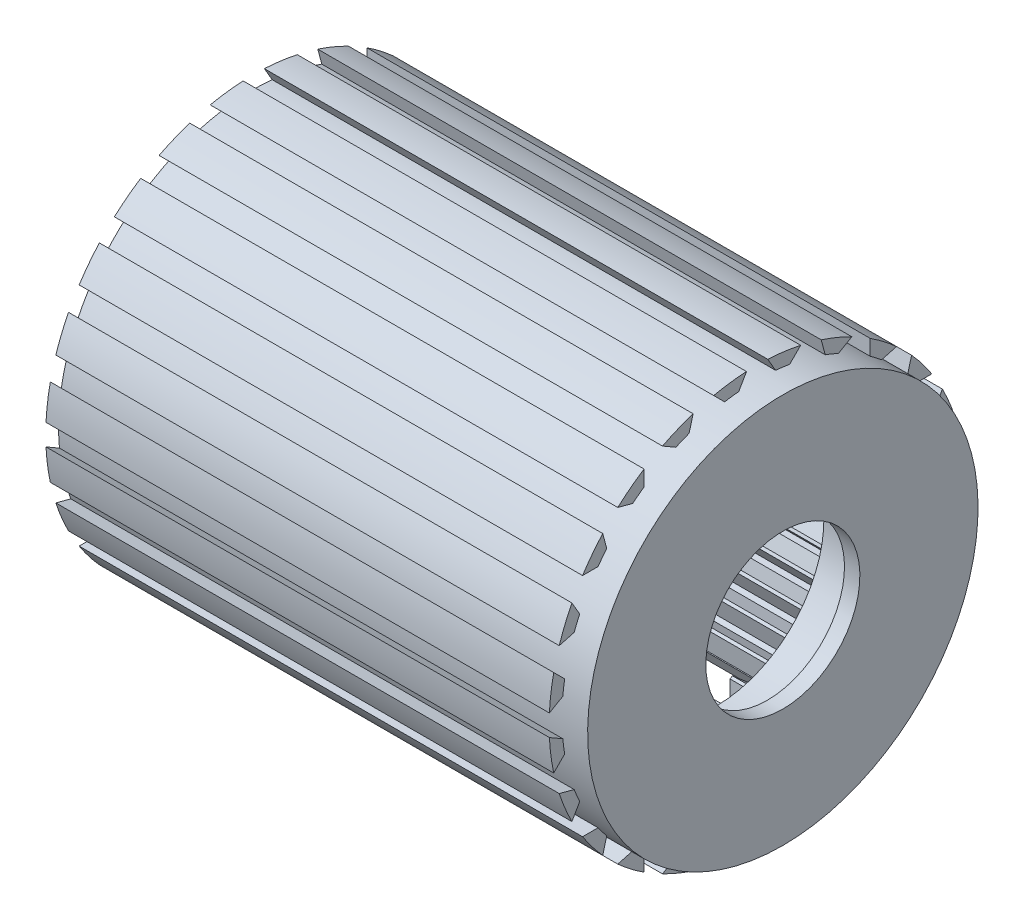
SolidWorks part; units mm, degrees
ref_plane "Plan1" through (0, 0, 0) normal (0, 0, 1) x (1, 0, 0)
ref_plane "Plan2" through (0, 0, 0) normal (0, 1, 0) x (1, 0, 0)
ref_plane "Plan3" through (0, 0, 0) normal (1, 0, 0) x (0, 0, -1)
sketch "Esquisse1" plane through (0, 0, 0) normal (0, 0, 1) x (1, 0, 0)
  line L0 (-68.3031, 40.5) -> (29.6969, 40.5)
  line L1 (29.6969, 40.5) -> (29.6969, 38)
  line L2 (29.6969, 38) -> (34.6969, 38)
  line L3 (34.6969, 38) -> (34.6969, 15)
  line L4 (34.6969, 15) -> (31.6969, 15)
  line L5 (31.6969, 15) -> (31.6969, 21)
  line L6 (31.6969, 21) -> (21.6969, 21)
  line L7 (21.6969, 21) -> (21.6969, 23)
  line L8 (21.6969, 23) -> (31.6969, 23)
  line L9 (31.6969, 23) -> (31.6969, 30.5)
  line L10 (31.6969, 30.5) -> (16.9403, 30.5)
  line L11 (16.9403, 30.5) -> (-25.3031, 30.5)
  line L12 (-25.3031, 30.5) -> (-25.3031, 34.5)
  line L13 (-25.3031, 34.5) -> (-68.3031, 34.5)
  line L14 (-68.3031, 34.5) -> (-68.3031, 40.5)
  line L15 (-68.3031, 0) -> (68.3031, 0) construction
  dimension "D1" = 98
  dimension "D2" = 43
  dimension "D3" = 40.5
  dimension "D4" = 34.5
  dimension "D5" = 38
  dimension "D6" = 15
  dimension "D7" = 21
  dimension "D8" = 10
  dimension "D9" = 3
  dimension "D10" = 2
  dimension "D11" = 4
  dimension "D12" = 100
revolve "Base-Révolution" add sketch "Esquisse1" angle 360 about L15
sketch "Esquisse2" plane through (29.6969, 0, 0) normal (1, 0, 0) x (0, 0, -1)
  line L0 (0, 0) -> (-43.5058, 0) construction
  line L1 (-41, -1.75) -> (-41, 1.75)
  line L2 (-41, 1.75) -> (-37.831, 3.5796)
  line L3 (-41, -1.75) -> (-37.831, -3.5796)
  circle A0 centre (0, 0) radius 38 construction
  arc A1 (-37.831, 3.5796) -> (-37.831, -3.5796) centre (0, 0) ccw
  point P7 (-41, 0)
  dimension "D1" = 3.5
  dimension "D2" = 41
  dimension "D3" = 120
extrude "Enlèv. mat.-Extru.1" cut sketch "Esquisse2" against normal through all
pattern_circular "Répétition circulaire1" count 28 every 15 about axis through (-68.3031, 0, 0) along (1, 0, 0)
sketch "Esquisse3" plane through (-25.3031, 0, 0) normal (-1, 0, 0) x (0, 0, 1)
  line L0 (0, 0) -> (0, 50.1709) construction
  line L1 (0.4625, 34.4969) -> (2.6417, 28.5097)
  line L2 (-0.4625, 34.4969) -> (-2.6417, 28.5097)
  line L3 (-0.4625, 34.4969) -> (0.4625, 34.4969)
  line L4 (2.6417, 28.5097) -> (-2.6417, 28.5097)
  circle A0 centre (0, 0) radius 34.5 construction
  point P9 (0, 32.0082)
  dimension "D1" = 20
extrude "Enlèv. mat.-Extru.2" cut sketch "Esquisse3" against normal up to surface (57 mm away)
pattern_circular "Répétition circulaire3" count 43 every 8.372
sketch "Esquisse4" plane through (0, 0, 0) normal (0, 0, 1) x (1, 0, 0)
  line L0 (21.7449, -22.9062) -> (21.7449, -30.4986)
  line L1 (31.6969, -22.9062) -> (-25.3031, -22.9062) construction
rib "Nervure1" sketch "Esquisse4" sketch "Esquisse4" thickness 1.5 extrusion direction parallel to sketch draft on no parameters "D1"=1.5
pattern_circular "Répétition circulaire4" count 21 every 16.744 about axis through (-68.3031, 0, 0) along (1, 0, 0)
sketch "Esquisse5" plane through (-68.3031, 0, 0) normal (-1, 0, 0) x (0, 0, 1)
  line L0 (0, 0) -> (23.4781, -40.7978)
  line L1 (0, 0) -> (-23.393, -40.8466)
  arc A0 (-23.393, -40.8466) -> (23.4781, -40.7978) centre (0, 0) ccw
extrude "Enlèv. mat.-Extru.3" cut sketch "Esquisse5" against normal blind 80
sketch "Esquisse6" plane through (-25.3031, 0, 0) normal (-1, 0, 0) x (0, 0, 1)
  line L0 (-4.7861, 31.8929) -> (0, 0)
  line L1 (0, 0) -> (0, 32.25)
  arc A0 (0, 32.25) -> (-4.7861, 31.8929) centre (0, 0) ccw
  dimension "D1" = 64.5
extrude "Enlèv. mat.-Extru.4" cut sketch "Esquisse6" against normal blind 10
